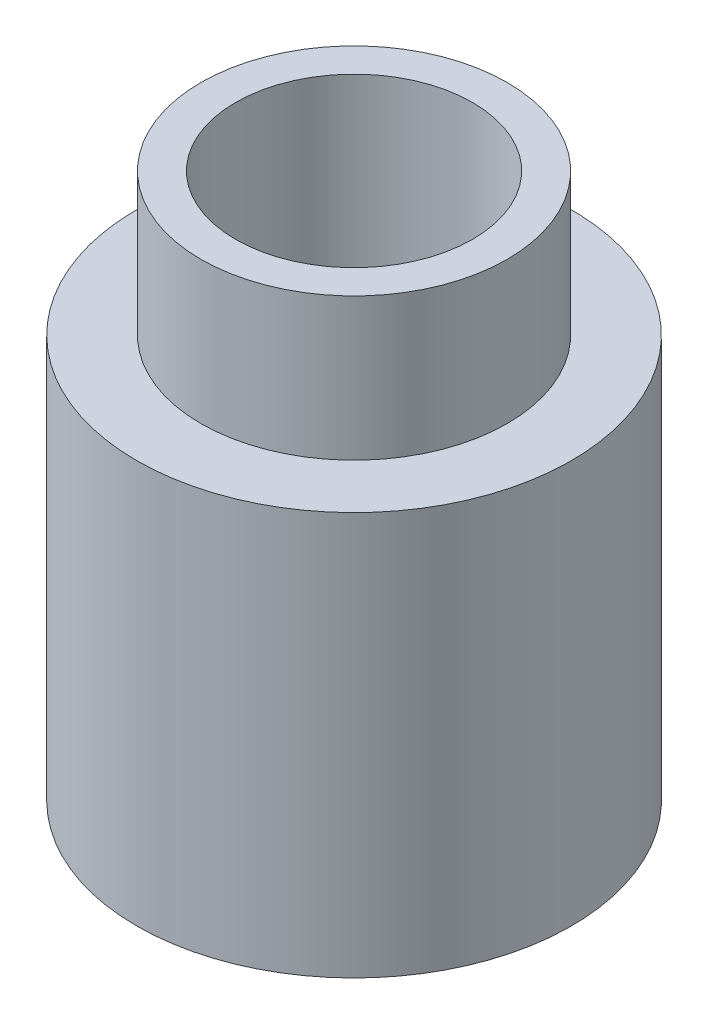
SolidWorks part; units mm, degrees
ref_plane "Front Plane" through (0, 0, 0) normal (0, 0, 1) x (1, 0, 0)
ref_plane "Top Plane" through (0, 0, 0) normal (0, 1, 0) x (1, 0, 0)
ref_plane "Right Plane" through (0, 0, 0) normal (1, 0, 0) x (0, 0, -1)
imported_body "Defeatured10"
sketch "Sketch1" plane through (0, 241.0215, 0) normal (0, -1, 0) x (-1, 0, 0)
  circle A0 centre (-41.6649, 0) radius 14.0716
extrude "Cut-Extrude2" cut sketch "Sketch1" against normal up to surface (0.0254 mm away)
sketch "Sketch2" plane through (0, 247.5223, 0) normal (0, -1, 0) x (-1, 0, 0)
  circle A0 centre (-41.6649, 0) radius 10.795
extrude "Cut-Extrude3" cut sketch "Sketch2" against normal up to surface (21.9154 mm away)
